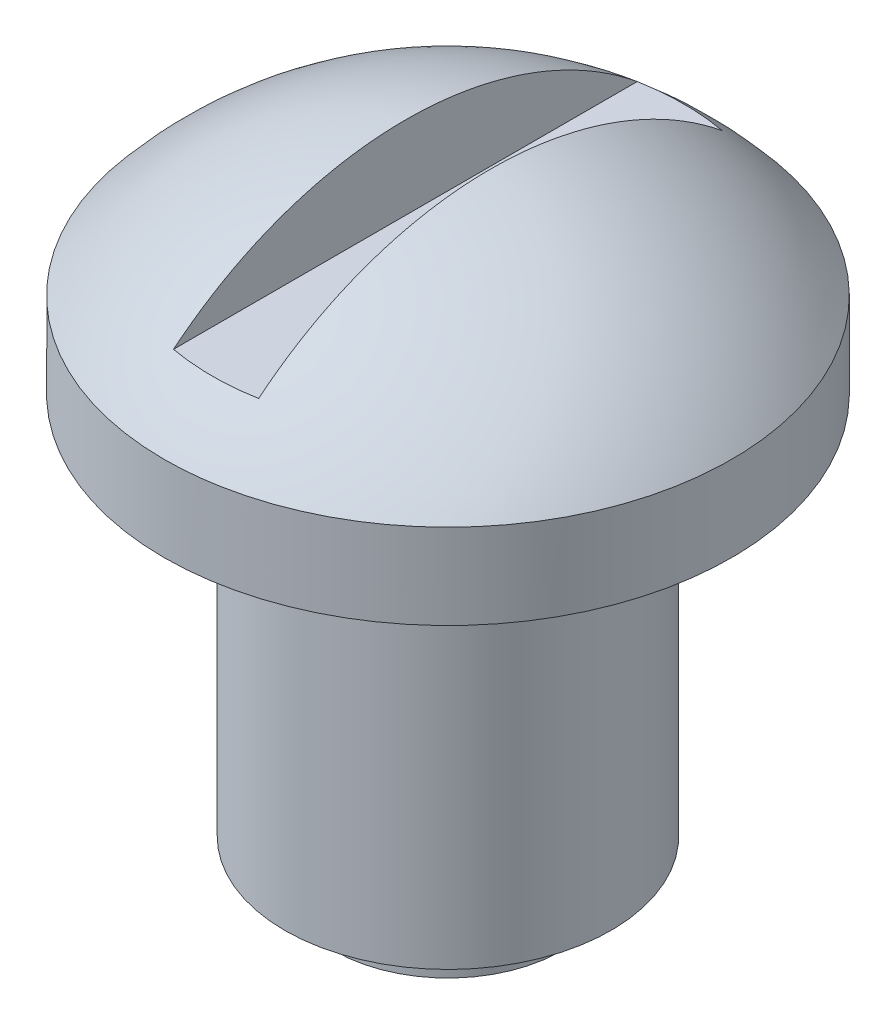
SolidWorks part; units mm, degrees
ref_plane "Front" through (0, 0, 0) normal (0, 0, 1) x (1, 0, 0)
ref_plane "Top" through (0, 0, 0) normal (0, 1, 0) x (1, 0, 0)
ref_plane "Right" through (0, 0, 0) normal (1, 0, 0) x (0, 0, -1)
sketch "Sketch1" plane through (0, 0, 0) normal (0, 0, 1) x (1, 0, 0)
  line L0 (0, 0) -> (0, -13.4472) construction
  line L1 (5, -2.3467) -> (5, -3.8467)
  line L2 (5, -3.8467) -> (2.875, -3.8467)
  line L3 (2.875, -3.8467) -> (2.875, -10.5967)
  line L4 (2.875, -10.5967) -> (2, -10.5967)
  line L5 (2, -10.5967) -> (2, -11.3467)
  line L6 (2, -11.3467) -> (0, -11.3467)
  line L7 (0, -11.3467) -> (0, 0)
  line L8 (0, 0) -> (-4.3386, 0) construction
  arc A0 (0, 0) -> (5, -2.3467) centre (0, -6.5) cw
  dimension "D7" = 6.5
  dimension "D1" = 4
  dimension "D2" = 5.75
  dimension "D3" = 0.75
  dimension "D4" = 6.75
  dimension "D5" = 1.5
  dimension "D6" = 10
revolve "Revolve1" add sketch "Sketch1" angle 360 about L0
sketch "Sketch2" plane through (0, 0, 0) normal (0, 0, 1) x (1, 0, 0)
  line L1 (-0.75, 0) -> (0.75, 0)
  line L2 (-0.75, 0) -> (-0.75, -1.5)
  line L3 (-0.75, -1.5) -> (0.75, -1.5)
  line L4 (0.75, 0) -> (0.75, -1.5)
  dimension "D1" = 1.5
  dimension "D2" = 1.5
extrude "Cut-Extrude1" cut sketch "Sketch2" against normal through all and the other way through all
